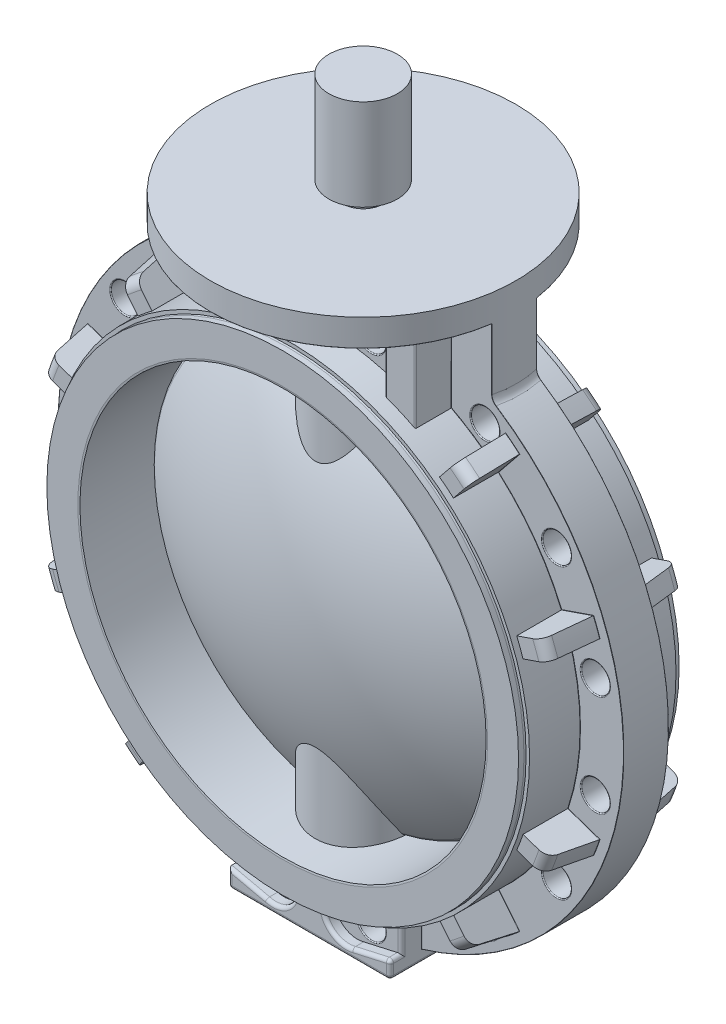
SolidWorks part; units mm, degrees
ref_plane "Front" through (0, 0, 0) normal (0, 0, 1) x (1, 0, 0)
ref_plane "Top" through (0, 0, 0) normal (0, 1, 0) x (1, 0, 0)
ref_plane "Right" through (0, 0, 0) normal (1, 0, 0) x (0, 0, -1)
sketch "Sketch1" plane through (0, 0, 0) normal (0, 0, 1) x (1, 0, 0)
  circle A0 centre (0, 0) radius 314.96
  circle A1 centre (0, 0) radius 228.6
  dimension "D1" = 629.92
  dimension "D2" = 457.2
extrude "Extrude1" add sketch "Sketch1" along normal mid plane 163
sketch "Sketch2" plane through (0, 0, 81.5) normal (0, 0, 1) x (1, 0, 0)
  circle A0 centre (0, 0) radius 266.7
  circle A1 centre (0, 0) radius 314.96 construction
  circle A2 centre (0, 0) radius 314.96
  dimension "D1" = 533.4
extrude "Cut-Extrude1" cut sketch "Sketch2" against normal blind 56.5
mirror "Mirror1" about plane through (0, 0, 0) normal (0, 0, 1) of "Cut-Extrude1"
ref_plane "Plane1" through (0, 370.078, 0) normal (0, 1, 0) x (-1, 0, 0)
sketch "Sketch3" plane through (0, 370.078, 0) normal (0, 1, 0) x (-1, 0, 0)
  circle A0 centre (0, 0) radius 170.053
  dimension "D1" = 340.106
extrude "Extrude2" add sketch "Sketch3" against normal blind 30
ref_plane "Plane2" through (0, -314.96, 0) normal (0, 1, 0) x (-1, 0, 0)
sketch "Sketch4" plane through (0, -314.96, 0) normal (0, 1, 0) x (-1, 0, 0)
  line L0 (90, 60) -> (90, -60)
  line L1 (-90, 60) -> (-90, -60)
  line L2 (0, 0) -> (0, 184.0621) construction
  line L3 (0, 0) -> (-322.6122, 0) construction
  line L4 (90, 60) -> (-90, 60)
  line L5 (90, -60) -> (-90, -60)
  dimension "D1" = 180
  dimension "D2" = 120
extrude "Extrude3" add sketch "Sketch4" along normal blind 76.2
sketch "Sketch6" plane through (0, 340.078, 0) normal (0, -1, 0) x (1, 0, 0)
  line L1 (0, 0) -> (0, -138.9352) construction
  line L2 (0, 0) -> (-336.2634, 0) construction
  line L4 (-90.0049, -59.9948) -> (90.0049, -59.9948)
  line L5 (-90.0049, -59.9948) -> (-90.0049, 59.9948)
  line L6 (-90.0049, 59.9948) -> (90.0049, 59.9948)
  line L7 (90.0049, -59.9948) -> (90.0049, 59.9948)
  dimension "D1" = 180.0098
  dimension "D2" = 119.9896
extrude "Extrude4" add sketch "Sketch6" along normal blind 101.6
sketch "Sketch5" plane through (0, 0, 60) normal (0, 0, 1) x (1, 0, 0)
  line L0 (0, 0) -> (0, -335.7316) construction
  line L1 (0, 0) -> (65.192, -327.7424) construction
  line L2 (-15.3668, -280.064) -> (-15.3668, -266.2569)
  line L3 (-97.8593, -293.3054) -> (-47.8761, -304.5465)
  line L5 (97.8593, -248.0977) -> (97.8593, -293.3054)
  line L6 (-97.8593, -248.0977) -> (-97.8593, -293.3054)
  line L7 (97.8593, -293.3054) -> (47.8761, -304.5465)
  line L8 (15.3668, -280.064) -> (15.3668, -266.2569)
  line L9 (0, 0) -> (333.902, 0) construction
  line L10 (-97.8593, 248.0977) -> (-97.8593, 293.3054)
  line L11 (97.8593, 293.3054) -> (47.8761, 304.5465)
  line L12 (15.3668, 280.064) -> (15.3668, 266.2569)
  line L13 (-15.3668, 280.064) -> (-15.3668, 266.2569)
  line L14 (97.8593, 293.3054) -> (97.8593, 248.0977)
  line L15 (-97.8593, 293.3054) -> (-47.8761, 304.5465)
  line L17 (0, 0) -> (0, 393.1166) construction
  line L19 (15.3668, 340.078) -> (90.0049, 340.078)
  line L20 (-90.0049, 340.078) -> (-90.0049, 315.1354)
  line L22 (-15.3668, 320.1458) -> (-15.3668, 340.078)
  line L23 (-15.3668, 340.078) -> (-90.0049, 340.078)
  line L24 (15.3668, 320.1458) -> (15.3668, 340.078)
  line L25 (90.0049, 340.078) -> (90.0049, 315.1354)
  circle A0 centre (0, 0) radius 288.925 construction
  circle A1 centre (56.3665, -283.3734) radius 15.875 construction
  circle A2 centre (-56.3665, -283.3734) radius 15.875 construction
  arc A3 (-90, -251.0556) -> (90, -251.0556) centre (0, 0) ccw construction
  circle A4 centre (0, 0) radius 266.7 construction
  arc A5 (47.8761, -304.5465) -> (15.3668, -280.064) centre (40.8402, -280.064) cw
  arc A6 (-47.8761, -304.5465) -> (-15.3668, -280.064) centre (-40.8402, -280.064) ccw
  arc A7 (97.8593, 248.0977) -> (15.3668, 266.2569) centre (0, 0) ccw
  circle A8 centre (56.3665, 283.3734) radius 15.875 construction
  circle A9 centre (-56.3665, 283.3734) radius 15.875 construction
  arc A10 (47.8761, 304.5465) -> (15.3668, 280.064) centre (40.8402, 280.064) ccw
  arc A11 (15.3668, -266.2569) -> (97.8593, -248.0977) centre (0, 0) ccw
  arc A12 (-97.8593, -248.0977) -> (-15.3668, -266.2569) centre (0, 0) ccw
  arc A13 (-47.8761, 304.5465) -> (-15.3668, 280.064) centre (-40.8402, 280.064) cw
  arc A15 (-97.8593, 248.0977) -> (-15.3668, 266.2569) centre (0, 0) cw
  arc A16 (-17.765, 317.6098) -> (-80.4576, 307.7631) centre (0, 0) ccw
  arc A17 (-15.3668, 320.1458) -> (-17.765, 317.6098) centre (-17.9068, 320.1458) cw
  arc A18 (-90.0049, 315.1354) -> (-80.4576, 307.7631) centre (-82.3849, 315.1354) ccw
  arc A19 (90.0049, 315.1354) -> (80.4576, 307.7631) centre (82.3849, 315.1354) cw
  arc A20 (15.3668, 320.1458) -> (17.765, 317.6098) centre (17.9068, 320.1458) ccw
  arc A21 (17.765, 317.6098) -> (80.4576, 307.7631) centre (0, 0) cw
  point P49 (-15.3668, 317.7348)
  dimension "D1" = 577.85
  dimension "D3" = 31.75
  dimension "D4" = 2.54
  dimension "D5" = 7.62
  dimension "D2" = 11.25
extrude "Cut-Extrude2" cut sketch "Sketch5" against normal blind 12.7
mirror "Mirror2" about plane through (0, 0, 0) normal (0, 0, 1) of "Cut-Extrude2"
fillet "Fillet1" radius 3.81 54 edges at (90, -314.96, 0) (0, -314.96, -60) (-90, -314.96, 0) (0, -314.96, 60) (68.9381, -299.8097, 60) (25.516, -300.4125, 60) (15.3668, -273.1605, 60) (-15.3668, -273.1605, 60) (-25.516, -300.4125, 60) (-68.9381, -299.8097, 60) (90, -273.0643, 47.3) (90, -295.073, 53.65) (90, -305.0165, 60) (90, -305.0165, -60) (90, -295.073, -53.65) (90, -273.0643, -47.3) (-90, -305.0165, 60) (-90, -273.0643, -47.3) (-90, -295.073, -53.65) (-90, -305.0165, -60) (-68.9381, -299.8097, -60) (-25.516, -300.4125, -60) (-15.3668, -273.1605, -60) (15.3668, -273.1605, -60) (25.516, -300.4125, -60) (68.9381, -299.8097, -60) (15.3668, 273.1605, 59.9948) (25.516, 300.4125, 59.9948) (68.9405, 299.8092, 59.9948) (-15.3668, 273.1605, 59.9948) (-25.516, 300.4125, 59.9948) (-68.9405, 299.8092, 59.9948) (-68.9405, 299.8092, -59.9948) (-25.516, 300.4125, -59.9948) (-15.3668, 273.1605, -59.9948) (15.3668, 273.1605, -59.9948) (25.516, 300.4125, -59.9948) (68.9405, 299.8092, -59.9948) (87.0421, 309.1042, 59.9948) (49.3574, 314.2537, 59.9948) (16.0613, 318.4006, 59.9948) (-15.3668, 330.1119, 59.9948) (-16.0613, 318.4006, 59.9948) (15.3668, 330.1119, 59.9948) (-49.3574, 314.2537, 59.9948) (-87.0421, 309.1042, 59.9948) (15.3668, 330.1119, -59.9948) (16.0613, 318.4006, -59.9948) (49.3574, 314.2537, -59.9948) (87.0421, 309.1042, -59.9948) (-15.3668, 330.1119, -59.9948) (-16.0613, 318.4006, -59.9948) (-87.0421, 309.1042, -59.9948) (-49.3574, 314.2537, -59.9948)
sketch "Sketch7" plane through (0, 340.078, 0) normal (0, -1, 0) x (1, 0, 0)
  line L0 (0, 0) -> (-192.9786, 0) construction
  line L1 (0, 0) -> (0, -186.455) construction
  line L2 (168.2053, -25) -> (90, -25)
  line L4 (168.2053, 25) -> (90, 25)
  line L7 (90, -25) -> (90, 25) construction
  line L8 (-90, -56.19) -> (-90, 56.19) construction
  line L9 (90, -25) -> (90, 25)
  line L10 (-90, -25) -> (-90, 25)
  line L11 (-90, 25) -> (-168.2053, 25)
  line L12 (-90, -25) -> (-168.2053, -25)
  circle A0 centre (0, 0) radius 170.053 construction
  arc A1 (168.2053, -25) -> (168.2053, 25) centre (0, 0) ccw
  arc A2 (-168.2053, 25) -> (-168.2053, -25) centre (0, 0) ccw
extrude "Extrude5" add sketch "Sketch7" along normal up to surface (89.0224 mm away)
sketch "Sketch8" plane through (0, 340.078, 0) normal (0, -1, 0) x (1, 0, 0)
  line L1 (0, 0) -> (0, -184.0388) construction
  line L2 (0, 0) -> (-189.6767, 0) construction
  line L3 (-90.0049, -59.9948) -> (-90.0049, -63.9161)
  line L4 (-90.0049, -59.9948) -> (-90.0049, 63.9161)
  line L5 (-91.2749, -65.1861) -> (-121.9466, -65.1861)
  line L6 (-91.2749, 65.1861) -> (-121.9466, 65.1861)
  line L7 (-123.2166, -63.9161) -> (-123.2166, 63.9161)
  line L8 (123.2166, -63.9161) -> (123.2166, 63.9161)
  line L9 (91.2749, 65.1861) -> (121.9466, 65.1861)
  line L10 (91.2749, -65.1861) -> (121.9466, -65.1861)
  line L11 (90.0049, -59.9948) -> (90.0049, 63.9161)
  line L12 (90.0049, -59.9948) -> (90.0049, -63.9161)
  arc A0 (-91.2749, -65.1861) -> (-90.0049, -63.9161) centre (-91.2749, -63.9161) ccw
  arc A1 (-123.2166, -63.9161) -> (-121.9466, -65.1861) centre (-121.9466, -63.9161) ccw
  arc A2 (-121.9466, 65.1861) -> (-123.2166, 63.9161) centre (-121.9466, 63.9161) ccw
  arc A3 (-90.0049, 63.9161) -> (-91.2749, 65.1861) centre (-91.2749, 63.9161) ccw
  arc A4 (90.0049, 63.9161) -> (91.2749, 65.1861) centre (91.2749, 63.9161) cw
  arc A5 (121.9466, 65.1861) -> (123.2166, 63.9161) centre (121.9466, 63.9161) cw
  arc A6 (123.2166, -63.9161) -> (121.9466, -65.1861) centre (121.9466, -63.9161) cw
  arc A7 (91.2749, -65.1861) -> (90.0049, -63.9161) centre (91.2749, -63.9161) cw
  dimension "D1" = 1.27
extrude "Extrude6" add sketch "Sketch8" along normal up to surface (89.0242 mm away)
sketch "Sketch9" plane through (0, 0, 25) normal (0, 0, 1) x (1, 0, 0)
  line L0 (0, 0) -> (0, 387.4491) construction
  line L1 (0, 0) -> (338.3533, 0) construction
  line L2 (245.89, 103.2813) -> (283.1196, 116.1005)
  line L3 (252.9408, 84.5567) -> (290.101, 97.3519)
  line L4 (252.9408, -84.5567) -> (290.101, -97.3519)
  line L5 (245.89, -103.2813) -> (283.1196, -116.1005)
  line L6 (0, 0) -> (231.4921, 285.8689) construction
  line L7 (200.2406, 231.3864) -> (175.4932, 200.8259)
  line L8 (184.6977, 243.9728) -> (159.9503, 213.4123)
  line L9 (-184.6977, 243.9728) -> (-159.9503, 213.4123)
  line L10 (-200.2406, 231.3864) -> (-175.4932, 200.8259)
  line L11 (-252.9408, 84.5567) -> (-290.101, 97.3519)
  line L12 (-245.89, 103.2813) -> (-283.1196, 116.1005)
  line L13 (184.6977, -243.9728) -> (159.9503, -213.4123)
  line L14 (200.2406, -231.3864) -> (175.4932, -200.8259)
  line L15 (-245.89, -103.2813) -> (-283.1196, -116.1005)
  line L16 (-252.9408, -84.5567) -> (-290.101, -97.3519)
  line L17 (-200.2406, -231.3864) -> (-175.4932, -200.8259)
  line L18 (-184.6977, -243.9728) -> (-159.9503, -213.4123)
  arc A1 (-283.1196, 116.1005) -> (-290.101, 97.3519) centre (0, 0) ccw
  arc A2 (175.4932, 200.8259) -> (159.9503, 213.4123) centre (0, 0) ccw
  circle A3 centre (0, 0) radius 266.7 construction
  arc A4 (200.2406, 231.3864) -> (184.6977, 243.9728) centre (0, 0) ccw
  arc A5 (245.89, -103.2813) -> (252.9408, -84.5567) centre (0, 0) ccw
  arc A8 (252.9408, 84.5567) -> (245.89, 103.2813) centre (0, 0) ccw
  arc A9 (-252.9408, 84.5567) -> (-245.89, 103.2813) centre (0, 0) cw
  arc A10 (-184.6977, 243.9728) -> (-200.2406, 231.3864) centre (0, 0) ccw
  arc A11 (-290.101, -97.3519) -> (-283.1196, -116.1005) centre (0, 0) ccw
  arc A12 (-175.4932, 200.8259) -> (-159.9503, 213.4123) centre (0, 0) cw
  arc A13 (-200.2406, -231.3864) -> (-184.6977, -243.9728) centre (0, 0) ccw
  arc A14 (184.6977, -243.9728) -> (200.2406, -231.3864) centre (0, 0) ccw
  arc A15 (175.4932, -200.8259) -> (159.9503, -213.4123) centre (0, 0) cw
  arc A16 (283.1196, -116.1005) -> (290.101, -97.3519) centre (0, 0) ccw
  arc A17 (290.101, 97.3519) -> (283.1196, 116.1005) centre (0, 0) ccw
  arc A18 (-175.4932, -200.8259) -> (-159.9503, -213.4123) centre (0, 0) ccw
  arc A21 (-252.9408, -84.5567) -> (-245.89, -103.2813) centre (0, 0) ccw
  dimension "D5" = 612
  dimension "D1" = 19
  dimension "D2" = 20
  dimension "D3" = 39
  dimension "D4" = 20
extrude "Extrude7" add sketch "Sketch9" along normal blind 50
mirror "Mirror6" about plane through (0, 0, 0) normal (0, 0, 1) of "Extrude7"
fillet "Fillet2" radius 10 1 edges
chamfer "Chamfer1" distance 60 angle 10 8 edges at (-286.7635, 106.7833, 75) (-192.572, -237.8067, 75) (-286.7635, -106.7833, 75) (-192.572, 237.8067, 75) (192.572, 237.8067, 75) (286.7635, 106.7833, 75) (286.7635, -106.7833, 75) (192.572, -237.8067, 75)
chamfer "Chamfer2" distance 60 angle 10 8 edges at (286.7635, -106.7833, -75) (-192.572, 237.8067, -75) (-286.7635, 106.7833, -75) (-286.7635, -106.7833, -75) (-192.572, -237.8067, -75) (192.572, -237.8067, -75) (192.572, 237.8067, -75) (286.7635, 106.7833, -75)
fillet "Fillet3" radius 0.254 116 edges at (285.0958, -106.2091, -25) (311.6313, -45.6701, -25) (-90, -276.4415, 25) (90, -276.4415, 25) (311.6313, -45.6701, 25) (-90, -276.4415, -25) (90, -276.4415, -25) (126.3845, -234.8528, -25) (126.3845, -234.8528, 25) (90, -301.8274, 0) (-90, -301.8274, 0) (0, 340.078, -170.053) (145.7109, 340.078, 25) (0, 340.078, 170.053) (-145.7109, 340.078, -25) (-142.0545, 225.7198, 25) (-142.0545, 225.7198, -25) (-145.7109, 340.078, 25) (-123.2166, 288.3041, 25) (-123.2166, 288.3041, -25) (145.7109, 340.078, -25) (123.2166, 288.3041, -25) (123.2166, 288.3041, 25) (216.263, 156.0744, 25) (270.6873, 90.6673, 25) (142.0545, 225.7198, 25) (187.3118, 215.4206, 25) (266.7, 0, 25) (263.6698, -109.4034, 25) (-266.7, 0, 25) (-263.6698, 109.4034, 25) (-216.263, 156.0744, 25) (-171.7689, 228.007, 25) (216.263, -156.0744, 25) (171.7689, -228.007, 25) (-126.3845, -234.8528, 25) (-187.3118, -215.4206, 25) (-216.263, -156.0744, 25) (-270.6873, -90.6673, 25) (216.263, 156.0744, -25) (270.6873, 90.6673, -25) (142.0545, 225.7198, -25) (187.3118, 215.4206, -25) (266.7, 0, -25) (263.6698, -109.4034, -25) (-266.7, 0, -25) (-263.6698, 109.4034, -25) (-216.263, 156.0744, -25) (-171.7689, 228.007, -25) (216.263, -156.0744, -25) (171.7689, -228.007, -25) (-126.3845, -234.8528, -25) (-187.3118, -215.4206, -25) (-216.263, -156.0744, -25) (-270.6873, -90.6673, -25) (-168.2053, 305.9439, -25) (-168.2053, 305.9439, 25) (168.2053, 305.9439, 25) (168.2053, 305.9439, -25) (-170.053, 270.5179, -0.0997) (170.0529, 270.5179, 0.1389) (174.5122, 262.1933, 0.1471) (-311.6313, -45.6701, -25) (-311.6313, -45.6701, 25) (-174.5122, 262.1932, -0.1055) (168.7785, 268.466, -25) (170.2995, 265.6563, 25) (-168.7785, 268.466, 25) (-170.2995, 265.6563, -25) (171.7689, 228.007, 25) (263.6698, 109.4034, 25) (270.6873, -90.6673, 25) (187.3118, -215.4206, 25) (-171.7689, -228.007, 25) (-263.6698, -109.4034, 25) (-187.3118, 215.4206, 25) (-270.6873, 90.6673, 25) (191.4624, 236.4363, 25) (285.0958, 106.2091, 25) (285.0958, -106.2091, 25) (191.4624, -236.4363, 25) (-191.4624, -236.4363, 25) (-285.0958, -106.2091, 25) (-191.4624, 236.4363, 25) (-285.0958, 106.2091, 25) (-187.3118, 215.4206, -25) (-270.6873, 90.6673, -25) (-263.6698, -109.4034, -25) (-171.7689, -228.007, -25) (187.3118, -215.4206, -25) (171.7689, 228.007, -25) (263.6698, 109.4034, -25) (270.6873, -90.6673, -25) (-191.4624, 236.4363, -25) (-285.0958, 106.2091, -25) (-285.0958, -106.2091, -25) (-191.4624, -236.4363, -25) (191.4624, -236.4363, -25) (191.4624, 236.4363, -25) (285.0958, 106.2091, -25)
fillet "Fillet5" radius 12 16 edges at (-185.9141, 229.5848, -75) (-276.757, 103.3381, -75) (-276.757, -103.3381, -75) (-185.9141, -229.5848, -75) (185.9141, -229.5848, -75) (276.757, -103.3381, -75) (276.757, 103.3381, -75) (185.9141, 229.5848, -75) (-185.9141, 229.5848, 75) (-276.757, 103.3381, 75) (-276.757, -103.3381, 75) (-185.9141, -229.5848, 75) (185.9141, -229.5848, 75) (276.757, -103.3381, 75) (276.757, 103.3381, 75) (185.9141, 229.5848, 75)
sketch "Sketch11" plane through (0, 0, 0) normal (0, 0, 1) x (1, 0, 0)
  circle A0 centre (0, 0) radius 288.925 construction
  circle A1 centre (56.3665, -283.3734) radius 15.875
  circle A2 centre (-56.3665, -283.3734) radius 15.875
  circle A3 centre (-160.5181, -240.2324) radius 15.875
  circle A4 centre (-240.2324, -160.5181) radius 15.875
  circle A5 centre (-283.3734, -56.3665) radius 15.875
  circle A6 centre (-283.3734, 56.3665) radius 15.875
  circle A7 centre (-240.2324, 160.5181) radius 15.875
  circle A8 centre (-160.5181, 240.2324) radius 15.875
  circle A9 centre (-56.3665, 283.3734) radius 15.875
  circle A10 centre (56.3665, 283.3734) radius 15.875
  circle A11 centre (160.5181, 240.2324) radius 15.875
  circle A12 centre (240.2324, 160.5181) radius 15.875
  circle A13 centre (283.3734, 56.3665) radius 15.875
  circle A14 centre (283.3734, -56.3665) radius 15.875
  circle A15 centre (240.2324, -160.5181) radius 15.875
  circle A16 centre (160.5181, -240.2324) radius 15.875
  dimension "D1" = 577.85
extrude "Cut-Extrude3" cut sketch "Sketch11" against normal through all and the other way through all
fillet "Fillet6" radius 1 32 edges at (72.2415, -283.3734, -47.3) (40.4915, -283.3734, 47.3) (-40.4915, -283.3734, 47.3) (-72.2415, -283.3734, -47.3) (-144.6431, -240.2324, 25) (-176.3931, -240.2324, -25) (-224.3574, -160.5181, 25) (-256.1074, -160.5181, -25) (-267.4984, -56.3665, 25) (-299.2484, -56.3665, -25) (-267.4984, 56.3665, 25) (-299.2484, 56.3665, -25) (-224.3574, 160.5181, 25) (-256.1074, 160.5181, -25) (-144.6431, 240.2324, 25) (-176.3931, 240.2324, -25) (-40.4915, 283.3734, -47.3) (-72.2415, 283.3734, 47.3) (72.2415, 283.3734, 47.3) (40.4915, 283.3734, -47.3) (176.3931, 240.2324, 25) (144.6431, 240.2324, -25) (256.1074, 160.5181, 25) (224.3574, 160.5181, -25) (299.2484, 56.3665, 25) (267.4984, 56.3665, -25) (299.2484, -56.3665, 25) (267.4984, -56.3665, -25) (256.1074, -160.5181, 25) (224.3574, -160.5181, -25) (176.3931, -240.2324, 25) (144.6431, -240.2324, -25)
sketch "Sketch12" plane through (0, 0, 0) normal (0, 0, 1) x (1, 0, 0)
  circle A0 centre (0, 0) radius 226.06
  circle A1 centre (0, 0) radius 262.509
  dimension "D1" = 452.12
  dimension "D2" = 525.018
extrude "Extrude8" add sketch "Sketch12" along normal mid plane 179.07
chamfer "Chamfer3" distance 2 angle 10 4 edges at (226.06, 0, -89.535) (226.06, 0, 89.535) (262.509, 0, 81.5) (262.509, 0, -89.535)
sketch "Sketch13" plane through (0, 0, 0) normal (0, 1, 0) x (1, 0, 0)
  line L0 (0, 0) -> (0, 179.6172) construction
  line L1 (0, 0) -> (338.4235, 0) construction
  line L2 (226.06, 3.3461) -> (226.06, -3.3461)
  line L3 (149.2507, 81.5) -> (-13.7168, 81.5) construction
  line L4 (266.7, 81.5) -> (-266.7, 81.5) construction
  line L5 (0, 78.0138) -> (0, -78.0138)
  arc A0 (222.715, 9.6539) -> (0, 78.0138) centre (0, -318.9662) ccw
  arc A1 (222.715, 9.6539) -> (226.06, 3.3461) centre (218.44, 3.3461) cw
  circle A2 centre (0, 0) radius 170.053 construction
  arc A3 (222.715, -9.6539) -> (226.06, -3.3461) centre (218.44, -3.3461) ccw
  arc A4 (222.715, -9.6539) -> (0, -78.0138) centre (0, 318.9662) cw
  point P21 (226.06, 0)
  dimension "D2" = 7.62
  dimension "D1" = 226.06
revolve "Revolve1" add sketch "Sketch13" angle 360 about L5
sketch "Sketch14" plane through (0, 0, 0) normal (0, 1, 0) x (1, 0, 0)
  circle A0 centre (0, 0) radius 53.332
extrude "Extrude9" add sketch "Sketch14" along normal mid plane 482.6
sketch "Sketch15" plane through (0, 370.078, 0) normal (0, 1, 0) x (1, 0, 0)
  circle A0 centre (0, 0) radius 22.225
  dimension "D1" = 44.45
extrude "Extrude10" add sketch "Sketch15" along normal blind 12.7
sketch "Sketch16" plane through (0, 382.778, 0) normal (0, 1, 0) x (1, 0, 0)
  circle A0 centre (0, 0) radius 38.1
  dimension "D1" = 76.2
extrude "Extrude11" add sketch "Sketch16" along normal blind 101.6
